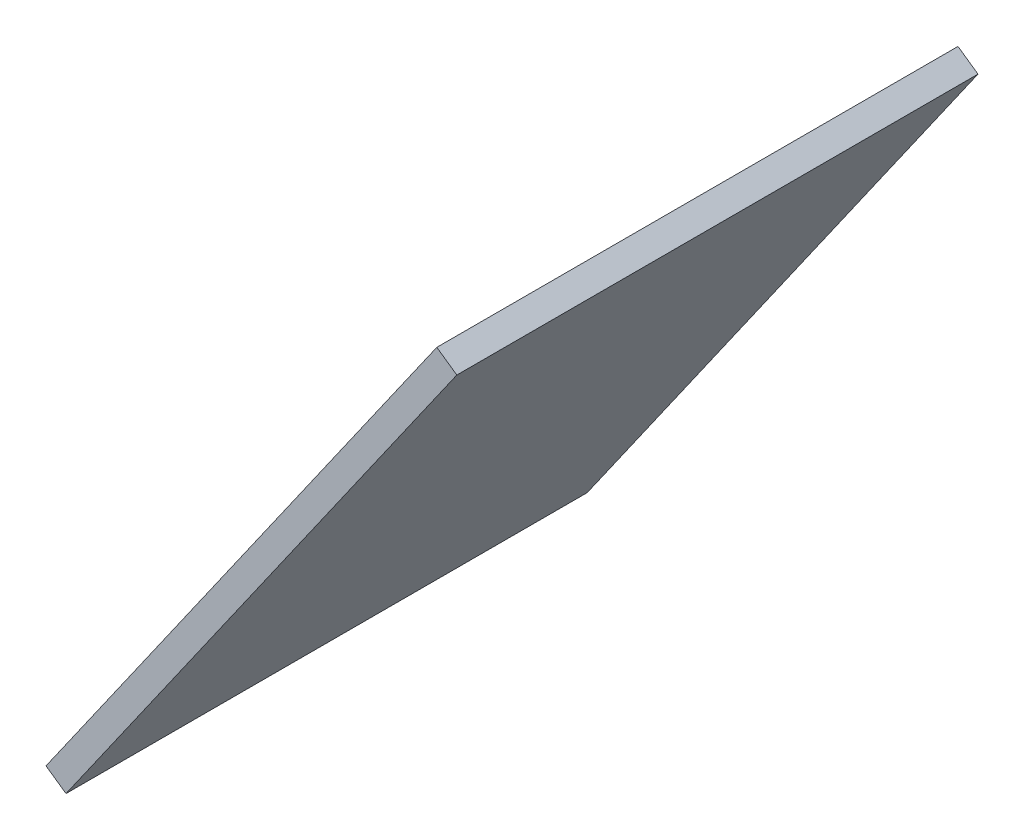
SolidWorks part; units mm, degrees
ref_plane "Plan de face" through (0, 0, 0) normal (0, 0, 1) x (1, 0, 0)
ref_plane "Plan de dessus" through (0, 0, 0) normal (0, 1, 0) x (1, 0, 0)
ref_plane "Plan de droite" through (0, 0, 0) normal (1, 0, 0) x (0, 0, -1)
sketch "Esquisse2" plane through (0, 0, 67.962) normal (0, 0, 1) x (1, 0, 0)
  line L0 (-4447.7774, 17434.4545) -> (-3322.952, 19040.1063)
  line L1 (-4447.7774, 17434.4545) -> (-4390.2357, 17394.1442)
  line L2 (-3322.952, 19040.1063) -> (-3265.4104, 18999.796)
  line L3 (-4390.2357, 17394.1442) -> (-3265.4104, 18999.796)
extrude "Boss.-Extru.1" add sketch "Esquisse2" along normal blind 1500
